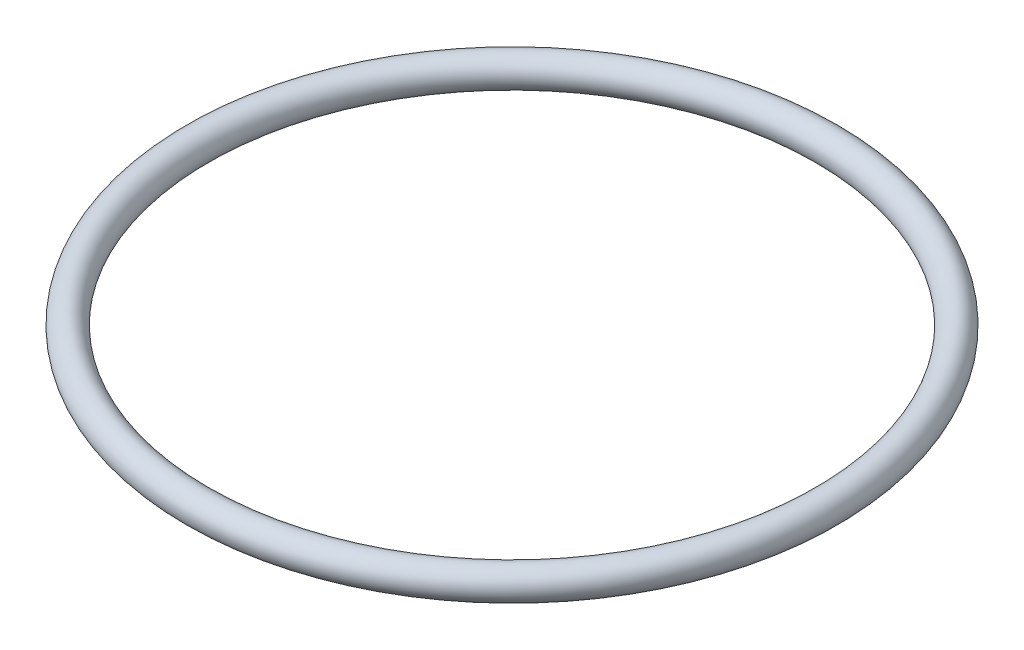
SolidWorks part; units mm, degrees
ref_plane "Front Plane" through (0, 0, 0) normal (0, 0, 1) x (1, 0, 0)
ref_plane "Top Plane" through (0, 0, 0) normal (0, 1, 0) x (1, 0, 0)
ref_plane "Right Plane" through (0, 0, 0) normal (1, 0, 0) x (0, 0, -1)
sketch "Sketch1" plane through (0, 0, 0) normal (0, 0, 1) x (1, 0, 0)
  line L0 (0, 3.7249) -> (0, 0) construction
  line L1 (0, 0) -> (17.3228, 0) construction
  circle A0 centre (18.2118, 0) radius 0.889
  dimension "D1" = 1.778
  dimension "D2" = 34.6456
revolve "Revolve1" add sketch "Sketch1" angle 360 about L0
